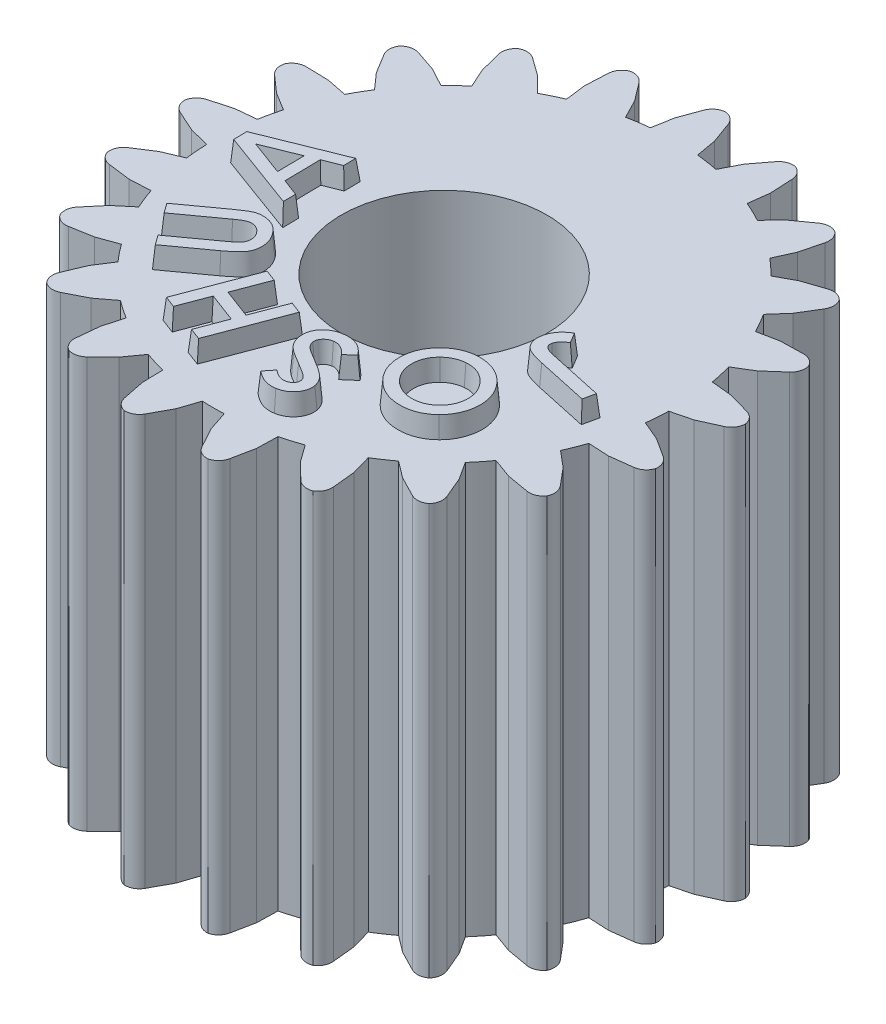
SolidWorks part; units mm, degrees
ref_plane "Front Plane" through (0, 0, 0) normal (0, 0, 1) x (1, 0, 0)
ref_plane "Top Plane" through (0, 0, 0) normal (0, 1, 0) x (1, 0, 0)
ref_plane "Right Plane" through (0, 0, 0) normal (1, 0, 0) x (0, 0, -1)
sketch "Sketch1" plane through (0, 0, 0) normal (0, 1, 0) x (1, 0, 0)
  circle A0 centre (0, 0) radius 28.575
  dimension "D1" = 57.15
extrude "Boss-Extrude1" add sketch "Sketch1" along normal blind 50.8
sketch "Sketch2" plane through (0, 50.8, 0) normal (0, 1, 0) x (1, 0, 0)
  line L0 (-2.921, 28.4253) -> (2.921, 28.4253)
  line L1 (2.921, 28.4253) -> (2.4731, 30.9653)
  line L2 (2.4731, 30.9653) -> (1.0864, 34.7753)
  line L3 (1.0864, 34.7753) -> (-1.0864, 34.7753)
  line L4 (-1.0864, 34.7753) -> (-2.4731, 30.9653)
  line L5 (-2.4731, 30.9653) -> (-2.921, 28.4253)
  circle A0 centre (0, 0) radius 28.575 construction
  dimension "D1" = 2.54
  dimension "D2" = 3.81
  dimension "D3" = 5.842
  dimension "D4" = 80
  dimension "D5" = 110
extrude "Boss-Extrude2" add sketch "Sketch2" against normal blind 50.8
fillet "Fillet1" radius 1.778 2 edges at (1.0864, 25.4, -34.7753) (-1.0864, 25.4, -34.7753)
pattern_circular "CirPattern1" count 21 over 360 about axis through (0, 0, 0) along (0, 1, 0) of "Fillet1", "Boss-Extrude2"
sketch "Sketch3" plane through (0, 50.8, 0) normal (0, 1, 0) x (1, 0, 0)
  circle A0 centre (0, 0) radius 12.7
  dimension "D1" = 25.4
extrude "Cut-Extrude1" cut sketch "Sketch3" against normal up to vertex
sketch "Sketch4" plane through (0, 50.8, 0) normal (0, 1, 0) x (1, 0, 0)
  circle A0 centre (0, 0) radius 15.875 construction
  circle A1 centre (0, 0) radius 12.7 construction
  arc A2 (-9.7016, -26.8777) -> (-7.1249, -27.6725) centre (0, 0) ccw construction
  text T0 "<b>JOSHUA</b>" font "Century Gothic" height 10.16
  dimension "D1" = 12.7
  dimension "D2" = 3.175
extrude "Boss-Extrude3" add sketch "Sketch4" along normal blind 2.54 draft 5
